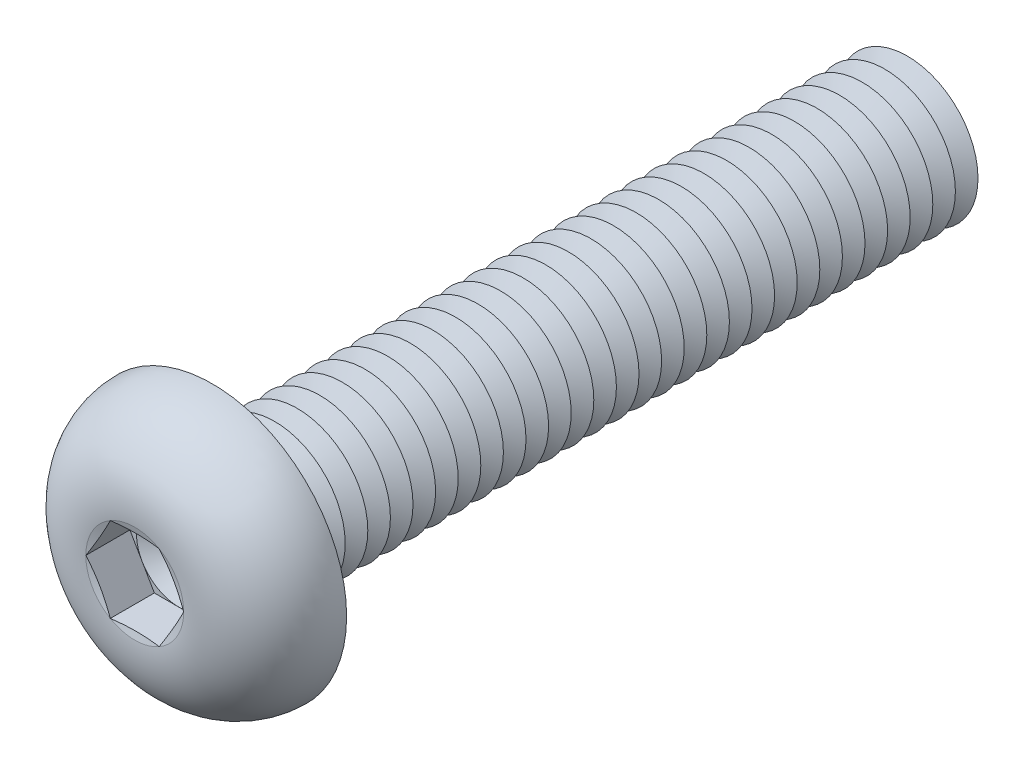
SolidWorks part; units mm, degrees
ref_plane "Front Plane" through (0, 0, 0) normal (0, 0, 1) x (1, 0, 0)
ref_plane "Top Plane" through (0, 0, 0) normal (0, 1, 0) x (1, 0, 0)
ref_plane "Right Plane" through (0, 0, 0) normal (1, 0, 0) x (0, 0, -1)
sketch "Sketch1" plane through (0, 0, 0) normal (1, 0, 0) x (0, 0, -1)
  line L0 (0, 2.5) -> (0, 4.75)
  line L3 (0, 2.5) -> (25, 2.5)
  line L4 (25, 2.5) -> (25, 0)
  line L5 (25, 0) -> (-2.75, 0) construction
  line L6 (-2.75, 0) -> (25, 0)
  line L7 (-2.75, 1.732) -> (-2.75, 0.866) construction
  line L8 (-2.75, 0.866) -> (-2.75, 0)
  line L9 (-2.75, 1.732) -> (-2.5179, 0.866)
  line L10 (-2.5179, 0.866) -> (-2.75, 0.866)
  line L11 (25, 0) -> (22.7481, 0) construction
  line L12 (0, 4.75) -> (-2.75, 4.75) construction
  arc A1 (0, 4.75) -> (-2.75, 1.732) centre (0, 1.9881) ccw
  point P8 (25, 1.25)
  dimension "D1" = 9.5
  dimension "D2" = 5
  dimension "D3" = 2.75
  dimension "D4" = 3.4641
  dimension "D5" = 25
  dimension "D6" = 15
revolve "Revolve1" add sketch "Sketch1" angle 360 about L5
fillet "Fillet1" radius 0.4 1 edges at (-2.5, 0, 0)
sketch "Sketch2" plane through (0, 0, 0) normal (1, 0, 0) x (0, 0, -1)
  line L0 (24.6, 2.5) -> (25.4, 2.5)
  line L1 (25, 2.5) -> (0.4, 2.5) construction
  line L2 (25.4, 2.5) -> (25, 1.8072)
  line L3 (25, -2.5) -> (25, 2.5) construction
  line L4 (25, 1.8072) -> (24.6, 2.5)
  dimension "D1" = 0.8
revolve "Cut-Revolve1" cut sketch "Sketch2" angle 360 about axis through (0, 0, -25) along (0, 0, -1)
pattern_linear "LPattern1" count 31 spacing 0.8 along (0, 0, 1) of "Cut-Revolve1"
sketch "Sketch3" plane through (0, 0, 2.75) normal (0, 0, 1) x (1, 0, 0)
  line L7 (0.866, 1.5) -> (-0.866, 1.5)
  line L8 (-0.866, 1.5) -> (-1.7321, 0)
  line L9 (-1.7321, 0) -> (-0.866, -1.5)
  line L10 (-0.866, -1.5) -> (0.866, -1.5)
  line L11 (0.866, -1.5) -> (1.7321, 0)
  line L12 (1.7321, 0) -> (0.866, 1.5)
  circle A0 centre (0, 0) radius 1.5 construction
  circle A3 centre (0, 0) radius 1.732 construction
extrude "Cut-Extrude1" cut sketch "Sketch3" against normal blind 1.56
sketch "Sketch4" plane through (0, 0, 1.19) normal (0, 0, 1) x (1, 0, 0)
  line L1 (0.866, 1.5) -> (-0.866, 1.5) construction
  circle A0 centre (0, 0) radius 1.5
extrude "Cut-Extrude2" cut sketch "Sketch4" against normal through all draft 60
